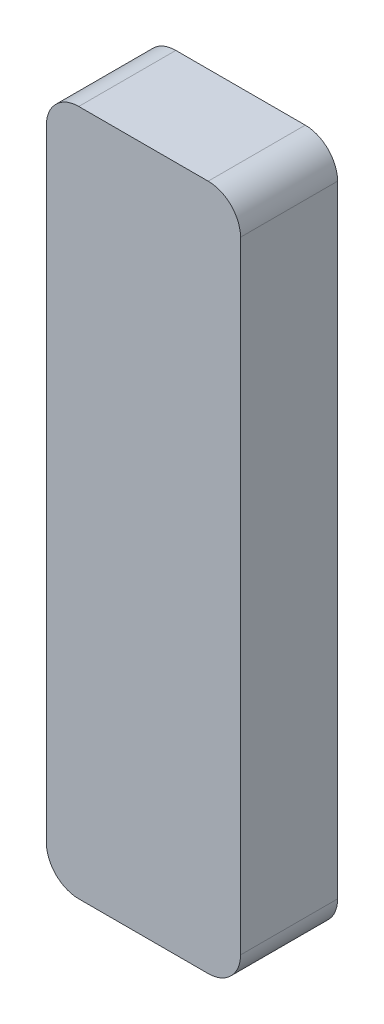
SolidWorks part; units mm, degrees
ref_plane "Front Plane" through (0, 0, 0) normal (0, 0, 1) x (1, 0, 0)
ref_plane "Top Plane" through (0, 0, 0) normal (0, 1, 0) x (1, 0, 0)
ref_plane "Right Plane" through (0, 0, 0) normal (1, 0, 0) x (0, 0, -1)
sketch "Sketch1" plane through (0, 0, 0) normal (0, 0, 1) x (1, 0, 0)
  line L1 (-2, 10.605) -> (2, 10.605)
  line L2 (-3, 9.605) -> (-3, -9.605)
  line L3 (-2, -10.605) -> (2, -10.605)
  line L4 (3, 9.605) -> (3, -9.605)
  line L5 (0, -10.605) -> (0, 10.605) construction
  line L6 (-3, 0) -> (3, 0) construction
  arc A0 (-2, -10.605) -> (-3, -9.605) centre (-2, -9.605) cw
  arc A1 (2, -10.605) -> (3, -9.605) centre (2, -9.605) ccw
  arc A2 (3, 9.605) -> (2, 10.605) centre (2, 9.605) ccw
  arc A3 (-2, 10.605) -> (-3, 9.605) centre (-2, 9.605) ccw
  point P0 (0, 0)
  point P10 (3, 10.605)
  point P14 (-3, 10.605)
  dimension "D3" = 1
  dimension "D1" = 6
  dimension "D2" = 21.21
extrude "Boss-Extrude1" add sketch "Sketch1" along normal blind 3
